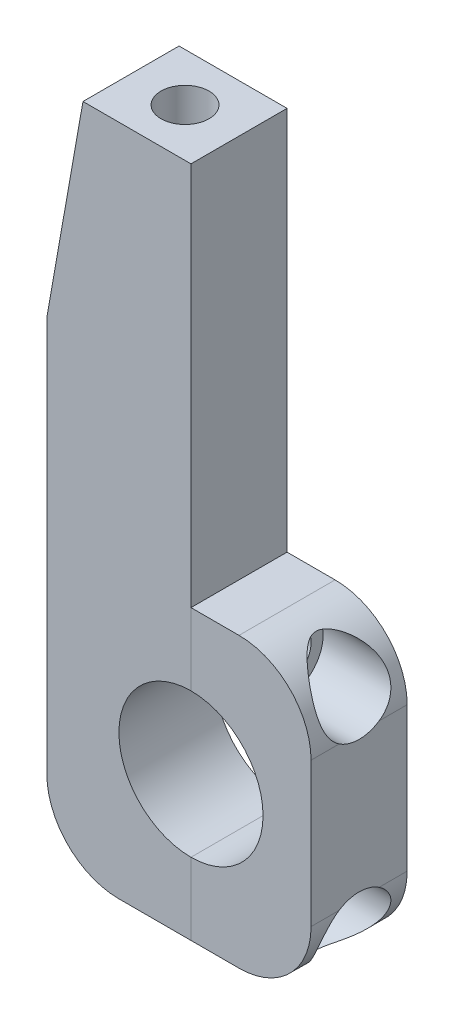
SolidWorks part; units mm, degrees
ref_plane "Front Plane" through (0, 0, 0) normal (0, 0, 1) x (1, 0, 0)
ref_plane "Top Plane" through (0, 0, 0) normal (0, 1, 0) x (1, 0, 0)
ref_plane "Right Plane" through (0, 0, 0) normal (1, 0, 0) x (0, 0, -1)
sketch "Sketch1" plane through (0, 0, 0) normal (0, 0, 1) x (1, 0, 0)
  line L0 (0, 0) -> (9.525, 0) construction
  line L1 (0, 0) -> (0, 9.525) construction
  line L2 (0, 9.525) -> (0, 19.05)
  line L3 (0, 19.05) -> (15.875, 19.05)
  line L4 (15.875, 19.05) -> (15.875, -19.05)
  line L5 (15.875, -19.05) -> (0, -19.05)
  line L6 (0, -19.05) -> (0, -9.525)
  line L7 (0, 19.05) -> (0, 69.85)
  line L8 (0, 69.85) -> (-19.05, 69.85)
  line L9 (-19.05, 69.85) -> (-19.05, -19.05)
  line L10 (-19.05, -19.05) -> (0, -19.05)
  line L11 (0, 13.4874) -> (15.875, 13.4874) construction
  line L12 (0, -13.4874) -> (15.875, -13.4874) construction
  line L13 (-7.1374, 69.85) -> (-7.1374, 52.4628) construction
  line L14 (-19.05, 42.7685) -> (-14.2748, 69.85)
  circle A0 centre (0, 0) radius 9.525
  dimension "D1" = 19.05
  dimension "D7" = 9.525
  dimension "D8" = 6.35
  dimension "D2" = 26.9748
  dimension "D3" = 38.1
  dimension "D4" = 19.05
  dimension "D5" = 15.875
  dimension "D6" = 69.85
  dimension "D9" = 7.1374
  dimension "D10" = 14.2748
  dimension "D11" = 10
sketch "Sketch2" plane through (0, 0, 0) normal (0, 0, 1) x (1, 0, 0)
  line L0 (0, 19.05) -> (0, 69.85) construction
  line L1 (0, 9.525) -> (0, 19.05) construction
  line L2 (0, -19.05) -> (0, -9.525) construction
  line L3 (-19.05, -19.05) -> (0, -19.05) construction
  line L4 (-19.05, 69.85) -> (-19.05, -19.05) construction
  line L5 (0, 69.85) -> (-19.05, 69.85) construction
  line L6 (0, 19.05) -> (0, 69.85)
  line L7 (0, 9.525) -> (0, 19.05)
  line L8 (0, -19.05) -> (0, -9.525)
  line L9 (-19.05, -19.05) -> (0, -19.05)
  line L10 (-19.05, 42.7685) -> (-19.05, -19.05)
  line L11 (0, 69.85) -> (-14.2748, 69.85)
  line L12 (-19.05, 42.7685) -> (-14.2748, 69.85) construction
  line L13 (-19.05, 42.7685) -> (-14.2748, 69.85)
  circle A0 centre (0, 0) radius 9.525 construction
  arc A1 (0, 9.525) -> (0, -9.525) centre (0, 0) ccw
extrude "Boss-Extrude1" add sketch "Sketch2" along normal mid plane 12.7
sketch "Sketch3" plane through (0, 0, 0) normal (0, 0, 1) x (1, 0, 0)
  line L0 (0, 9.525) -> (0, 19.05) construction
  line L1 (0, -19.05) -> (0, -9.525) construction
  line L2 (15.875, -19.05) -> (0, -19.05) construction
  line L3 (15.875, 19.05) -> (15.875, -19.05) construction
  line L4 (0, 19.05) -> (15.875, 19.05) construction
  line L5 (0, 9.525) -> (0, 19.05)
  line L6 (0, -19.05) -> (0, -9.525)
  line L7 (15.875, -19.05) -> (0, -19.05)
  line L8 (15.875, 19.05) -> (15.875, -19.05)
  line L9 (0, 19.05) -> (15.875, 19.05)
  circle A0 centre (0, 0) radius 9.525 construction
  arc A1 (0, -9.525) -> (0, 9.525) centre (0, 0) ccw
extrude "Boss-Extrude2" add sketch "Sketch3" along normal mid plane 12.7 separate body
fillet "Fillet1" radius 9.525 2 edges at (15.875, -19.05, 0) (15.875, 19.05, 0)
sketch "Sketch4" plane through (0, 0, 0) normal (1, 0, 0) x (0, 0, -1)
  circle A0 centre (0, 13.4874) radius 3.175
  circle A1 centre (0, 13.4874) radius 4.7625
  circle A2 centre (0, -13.4874) radius 3.175
  circle A3 centre (0, -13.4874) radius 4.7625
  dimension "D1" = 9.525
  dimension "D2" = 6.35
sketch "Sketch5" plane through (0, 0, 0) normal (1, 0, 0) x (0, 0, -1)
  circle A0 centre (0, 13.4874) radius 3.175 construction
  circle A1 centre (0, -13.4874) radius 3.175 construction
  circle A2 centre (0, 13.4874) radius 3.175
  circle A3 centre (0, -13.4874) radius 3.175
extrude "Cut-Extrude1" cut sketch "Sketch5" against normal blind 17.4752 and the other way blind 25.4
chamfer "Chamfer1" distance 1.778 angle 59 2 edges at (-17.4752, 13.4874, -3.175) (-17.4752, -13.4874, -3.175)
fillet "Fillet2" radius 9.525 1 edges at (-19.05, -19.05, 0)
sketch "Sketch6" plane through (0, 0, 0) normal (1, 0, 0) x (0, 0, -1)
  circle A0 centre (0, 13.4874) radius 4.7625 construction
  circle A1 centre (0, -13.4874) radius 4.7625 construction
  circle A2 centre (0, 13.4874) radius 4.7625
  circle A3 centre (0, -13.4874) radius 4.7625
extrude "Cut-Extrude2" cut sketch "Sketch6" along normal blind 15.875 from offset 6.35
hole_wizard "1/4 (0.25) Diameter Hole1" positions "Sketch8" profile "Sketch7" hole size "1/4" standard "ANSI Inch"
sketch "Sketch8" plane through (0, 69.85, 0) normal (0, 1, 0) x (1, 0, 0)
  point P0 (-7.1374, 0)
sketch "Sketch7" plane through (-7.1374, 69.85, 0) normal (1, 0, 0) x (0, 0, 1)
  line L0 (0, 0) -> (0, 19.0527)
  line L1 (0, 19.0527) -> (3.175, 17.145)
  line L2 (3.175, 17.145) -> (3.175, 0)
  line L5 (3.175, 0) -> (0, 0)
  line L10 (0, 19.0527) -> (-3.175, 17.145) construction
  line L11 (0, -6.35) -> (0, 107.95) construction
  dimension "Hole Dia." = 6.35
  dimension "Hole Depth" = 17.145
  dimension "Drill Angle" = 118
sketch "Sketch9" plane through (0, 0, 0) normal (1, 0, 0) x (0, 0, -1)
  circle A0 centre (0, 25.4) radius 3.175
  dimension "D1" = 6.35
  dimension "D2" = 25.4
extrude "Cut-Extrude3" [suppressed] cut sketch "Sketch9" against normal blind 25.4
